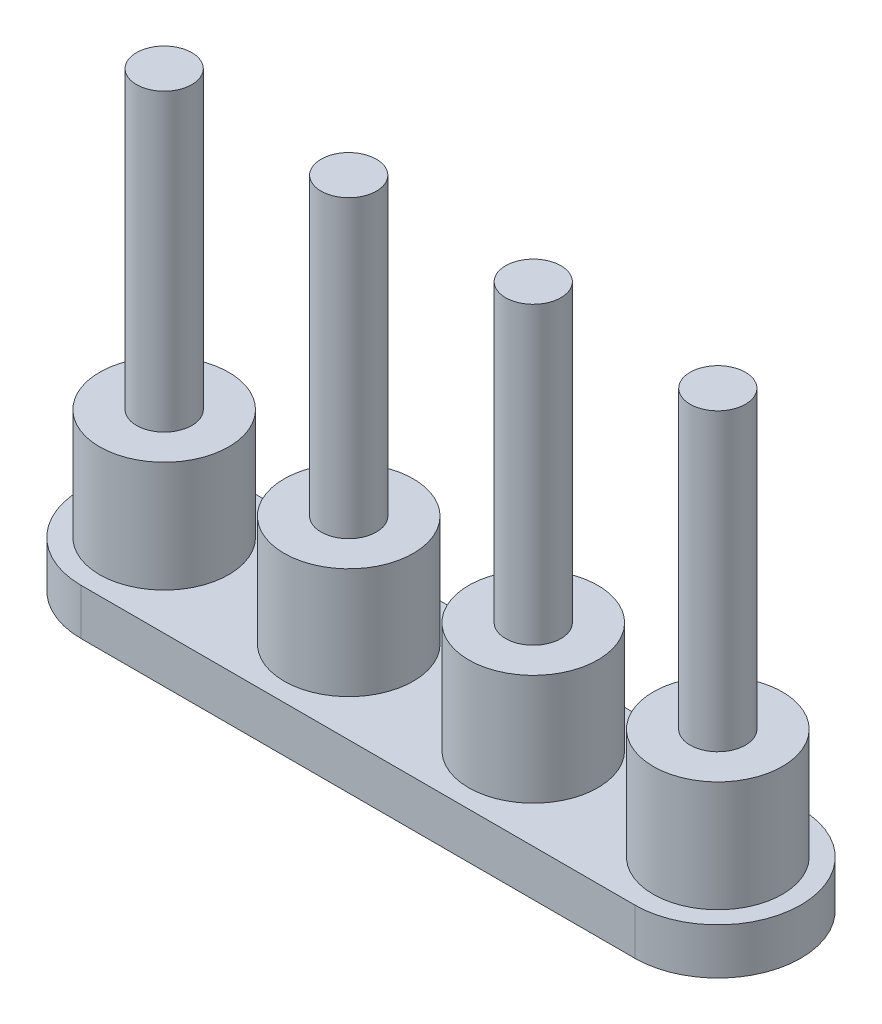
SolidWorks part; units mm, degrees
ref_plane "Plan de face" through (0, 0, 0) normal (0, 0, 1) x (1, 0, 0)
ref_plane "Plan de dessus" through (0, 0, 0) normal (0, 1, 0) x (1, 0, 0)
ref_plane "Plan de droite" through (0, 0, 0) normal (1, 0, 0) x (0, 0, -1)
sketch "Esquisse1" plane through (0, 0, 0) normal (0, 1, 0) x (1, 0, 0)
  line L0 (-15, 4.5) -> (15, 4.5)
  line L1 (-15, -4.5) -> (15, -4.5)
  arc A0 (-15, 4.5) -> (-15, -4.5) centre (-15, 0) ccw
  arc A1 (15, 4.5) -> (15, -4.5) centre (15, 0) cw
  dimension "D2" = 4.5
  dimension "D1" = 30
  dimension "D3" = 4.5
  dimension "D4" = 15
extrude "Extrusion1" add sketch "Esquisse1" along normal blind 2.5
sketch "Esquisse2" plane through (0, 2.5, 0) normal (0, 1, 0) x (-1, 0, 0)
  line L0 (15, 4.5) -> (-15, 4.5) construction
  circle A0 centre (-15, 0) radius 3.5
  dimension "D3" = 7
  dimension "D1" = 15
  dimension "D2" = 4.5
extrude "Extrusion2" add sketch "Esquisse2" along normal blind 6
sketch "Esquisse3" plane through (0, 2.5, 0) normal (0, 1, 0) x (-1, 0, 0)
  line L0 (15, 4.5) -> (-15, 4.5) construction
  circle A0 centre (15, 0) radius 3.5
  dimension "D3" = 7
  dimension "D1" = 15
  dimension "D2" = 4.5
extrude "Extrusion3" add sketch "Esquisse3" along normal blind 6
sketch "Esquisse4" plane through (0, 2.5, 0) normal (0, 1, 0) x (-1, 0, 0)
  line L0 (15, 4.5) -> (-15, 4.5) construction
  circle A0 centre (-5, 0) radius 3.5
  dimension "D3" = 7
  dimension "D1" = 5
  dimension "D2" = 4.5
extrude "Extrusion4" add sketch "Esquisse4" along normal blind 6
sketch "Esquisse5" plane through (0, 2.5, 0) normal (0, 1, 0) x (-1, 0, 0)
  line L0 (15, 4.5) -> (-15, 4.5) construction
  circle A0 centre (5, 0) radius 3.5
  dimension "D3" = 7
  dimension "D1" = 5
  dimension "D2" = 4.5
extrude "Extrusion5" add sketch "Esquisse5" along normal blind 6
sketch "Esquisse7" plane through (0, 8.5, 0) normal (0, 1, 0) x (-1, 0, 0)
  line L0 (15, 4.5) -> (-15, 4.5) construction
  circle A0 centre (-5, 0) radius 1.5
  dimension "D3" = 3
  dimension "D1" = 5
  dimension "D2" = 4.5
extrude "Extrusion7" add sketch "Esquisse7" along normal blind 16
sketch "Esquisse8" plane through (0, 8.5, 0) normal (0, 1, 0) x (-1, 0, 0)
  line L0 (15, 4.5) -> (-15, 4.5) construction
  circle A0 centre (5, 0) radius 1.5
  dimension "D3" = 3
  dimension "D1" = 4.5
  dimension "D2" = 5
extrude "Extrusion8" add sketch "Esquisse8" along normal blind 16
sketch "Esquisse9" plane through (0, 8.5, 0) normal (0, 1, 0) x (-1, 0, 0)
  line L0 (15, 4.5) -> (-15, 4.5) construction
  circle A0 centre (15, 0) radius 1.5
  dimension "D3" = 3
  dimension "D1" = 15
  dimension "D2" = 4.5
extrude "Extrusion9" add sketch "Esquisse9" along normal blind 16
sketch "Esquisse13" plane through (0, 0, 0) normal (0, -1, 0) x (1, 0, 0)
  line L0 (0, 0) -> (0, -11.4619) construction
  line L1 (15, -4.5) -> (-15, -4.5) construction
  line L2 (3, -4.5) -> (-3, -4.5)
  arc A0 (3, -4.5) -> (-3, -4.5) centre (0, -4.5109) cw
  dimension "D1" = 3
extrude "Extrusion13" add sketch "Esquisse13" against normal blind 2.5
sketch "Esquisse14" plane through (0, 8.5, 0) normal (0, 1, 0) x (-1, 0, 0)
  line L0 (15, 4.5) -> (-15, 4.5) construction
  circle A0 centre (-15, 0) radius 1.5
  dimension "D3" = 3
  dimension "D1" = 15
  dimension "D2" = 4.5
extrude "Extrusion14" add sketch "Esquisse14" along normal blind 16
